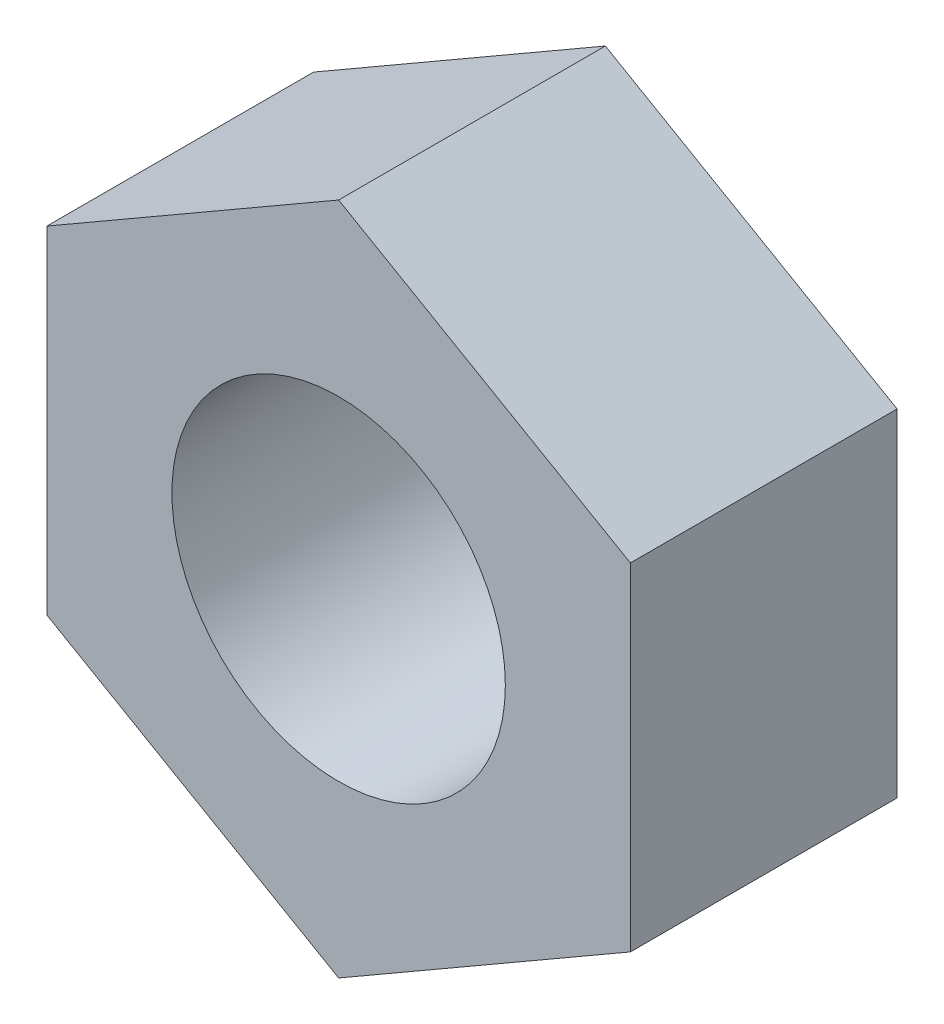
SolidWorks part; units mm, degrees
ref_plane "前视基准面" through (0, 0, 0) normal (0, 0, 1) x (1, 0, 0)
ref_plane "上视基准面" through (0, 0, 0) normal (0, 1, 0) x (1, 0, 0)
ref_plane "右视基准面" through (0, 0, 0) normal (1, 0, 0) x (0, 0, -1)
other "Configuration Table"
sketch "草图1" plane through (0, 0, 0) normal (0, 0, 1) x (1, 0, 0)
  line L0 (3.5, 2.0207) -> (0, 4.0415)
  line L1 (0, 4.0415) -> (-3.5, 2.0207)
  line L2 (-3.5, 2.0207) -> (-3.5, -2.0207)
  line L3 (-3.5, -2.0207) -> (0, -4.0415)
  line L4 (0, -4.0415) -> (3.5, -2.0207)
  line L5 (3.5, -2.0207) -> (3.5, 2.0207)
  circle A0 centre (0, 0) radius 2
  dimension "D1" = 4
  dimension "D2" = 3.5
  dimension "D3" = 2.0207
  dimension "D4" = 4.0415
extrude "Plain_M4_AF7_height3p2" add sketch "草图1" along normal blind 3.2
